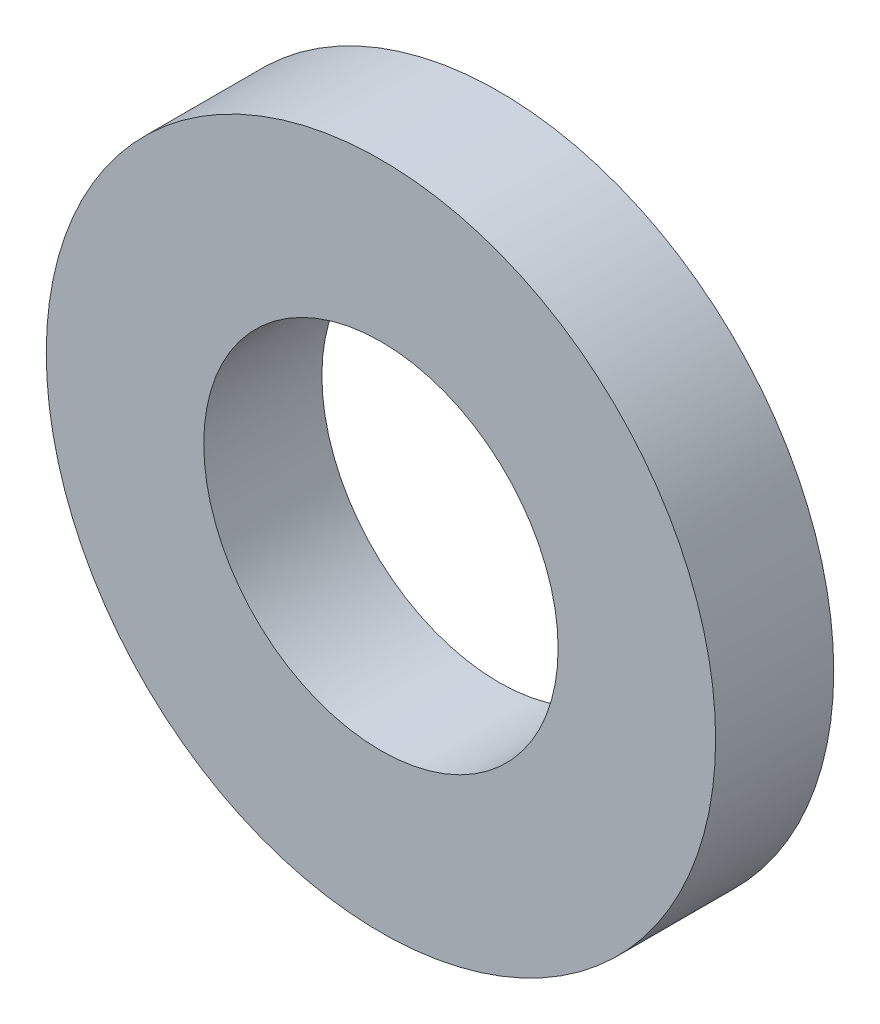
SolidWorks part; units mm, degrees
ref_plane "Plan de face" through (0, 0, 0) normal (0, 0, 1) x (1, 0, 0)
ref_plane "Plan de dessus" through (0, 0, 0) normal (0, 1, 0) x (1, 0, 0)
ref_plane "Plan de droite" through (0, 0, 0) normal (1, 0, 0) x (0, 0, -1)
sketch "Esquisse1" plane through (0, 0, 0) normal (0, 0, 1) x (1, 0, 0)
  circle A0 centre (0, 0) radius 2.25
  dimension "D1" = 4.5
extrude "Extru.-Mince1" add sketch "Esquisse1" along normal blind 1.5 thin
